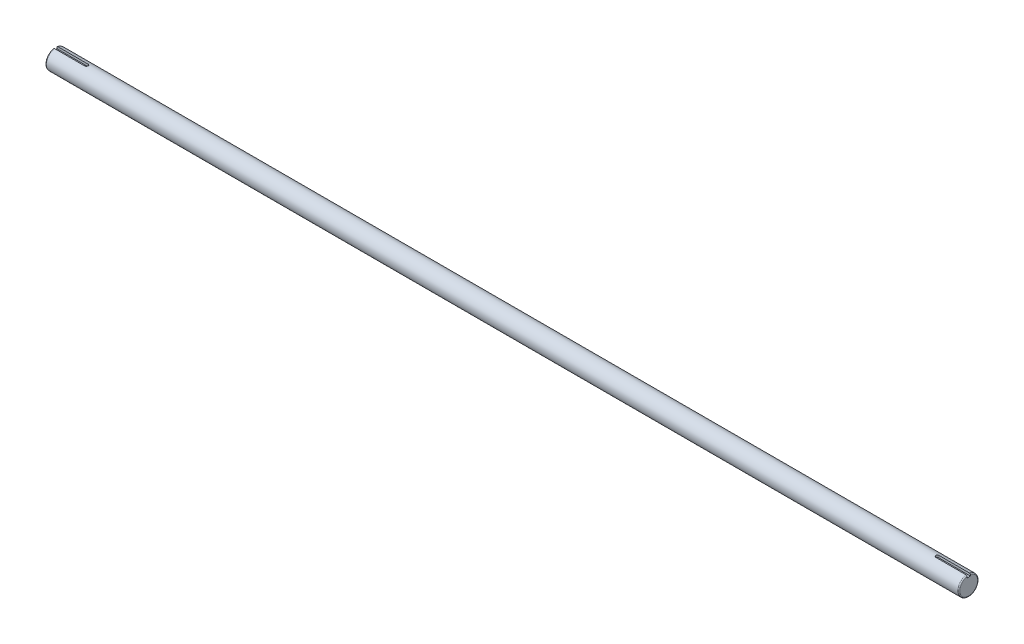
SolidWorks part; units mm, degrees
ref_plane "Front Plane" through (0, 0, 0) normal (0, 0, 1) x (1, 0, 0)
ref_plane "Top Plane" through (0, 0, 0) normal (0, 1, 0) x (1, 0, 0)
ref_plane "Right Plane" through (0, 0, 0) normal (1, 0, 0) x (0, 0, -1)
sketch "Sketch1" plane through (0, 0, 0) normal (1, 0, 0) x (0, 0, -1)
  circle A0 centre (0, 0) radius 7.62
  dimension "D1" = 15.24
extrude "Boss-Extrude1" add sketch "Sketch1" along normal mid plane 706.12
fillet "Fillet1" radius 0.762 2 edges at (353.06, 0, -7.62) (-353.06, 0, -7.62)
ref_plane "Plane1" through (0, 7.62, 0) normal (0, 1, 0) x (1, 0, 0)
sketch "Sketch2" plane through (0, 7.62, 0) normal (0, 1, 0) x (1, 0, 0)
  line L0 (-375.6305, 0) -> (49000, 0) construction
  line L1 (0, -1000) -> (0, 49000) construction
  line L2 (-375.6305, 0) -> (-328.93, 0) construction
  line L3 (-353.06, 6.858) -> (-353.06, -6.858) construction
  line L4 (-353.06, -1.27) -> (-328.93, -1.27)
  line L5 (-353.06, 1.27) -> (-328.93, 1.27)
  line L6 (-353.06, -1.27) -> (-353.06, 1.27)
  line L7 (353.06, -1.27) -> (353.06, 1.27)
  line L8 (353.06, 1.27) -> (328.93, 1.27)
  line L9 (353.06, -1.27) -> (328.93, -1.27)
  arc A0 (328.93, 1.27) -> (328.93, -1.27) centre (328.93, 0) ccw
  arc A1 (-328.93, -1.27) -> (-328.93, 1.27) centre (-328.93, 0) ccw
  point P9 (-353.06, 0)
  point P19 (353.06, 0)
  dimension "D1" = 2.54
  dimension "D3" = 24.13
  dimension "D4" = 2.54
extrude "Cut-Extrude1" cut sketch "Sketch2" against normal blind 1.8161
